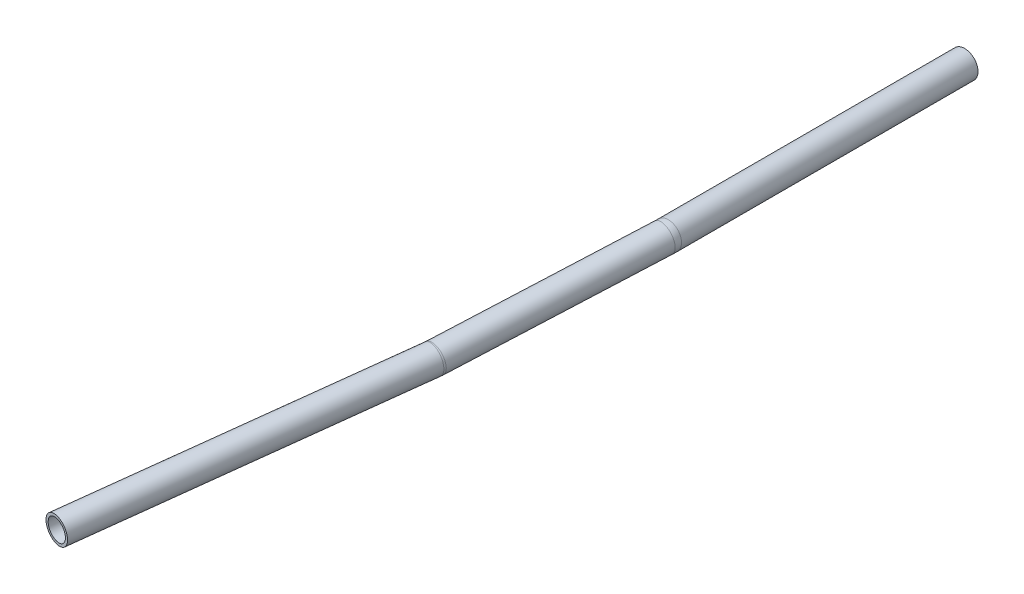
SolidWorks part; units mm, degrees
ref_plane "Front" through (0, 0, 0) normal (0, 0, 1) x (1, 0, 0)
ref_plane "Top" through (0, 0, 0) normal (0, 1, 0) x (1, 0, 0)
ref_plane "Side" through (0, 0, 0) normal (1, 0, 0) x (0, 0, -1)
sketch "PipeSketch"
  dimension "OuterDiameter" = 1
  dimension "InnerDiameter" = 0.8
sketch "FilterSketch" plane through (0, 0, 0) normal (0, 0, 1) x (1, 0, 0)
  circle A0 centre (0, 0) radius 0.05 construction
  dimension "NominalDiameter" = 0.1
sketch3d "3DSketch1"
  line L0 (0, 0, 10) -> (0, 0, 11.0843) construction
  line L1 (-0.0106, -0.0067, 11.2421) -> (-1.0291, -0.6509, 18.7836) construction
  line L2 (-1.0377, -0.6548, 18.8373) -> (-3.2101, -1.3271, 30.7345) construction
  line L3 (0, 0, 0) -> (0, 0, 11.0843)
  line L4 (-0.0106, -0.0067, 11.2421) -> (-1.0291, -0.6509, 18.7836)
  line L5 (-1.0377, -0.6548, 18.8373) -> (-3.2101, -1.3271, 30.7345)
  arc A0 (0, 0, 11.0843) -> (-0.0106, -0.0067, 11.2421) centre (-0.8451, -0.5346, 11.0843) ccw construction
  arc A1 (-1.0291, -0.6509, 18.7836) -> (-1.0377, -0.6548, 18.8373) centre (-1.8763, -0.1242, 18.7142) ccw construction
  arc A2 (0, 0, 11.0843) -> (-0.0106, -0.0067, 11.2421) centre (-0.8451, -0.5346, 11.0843) ccw
  arc A3 (-1.0291, -0.6509, 18.7836) -> (-1.0377, -0.6548, 18.8373) centre (-1.8763, -0.1242, 18.7142) ccw
  point P6 (-0.3106, -1.3797, 11.0843)
  point P8 (-0.3106, -1.3797, 11.0843)
  point P10 (-2.3906, -0.97, 18.5725)
  point P12 (-2.3906, -0.97, 18.5725)
sweep "ThinSweep" add profiles "PipeSketch" path "3DSketch1" parameters "D1"=0.1
